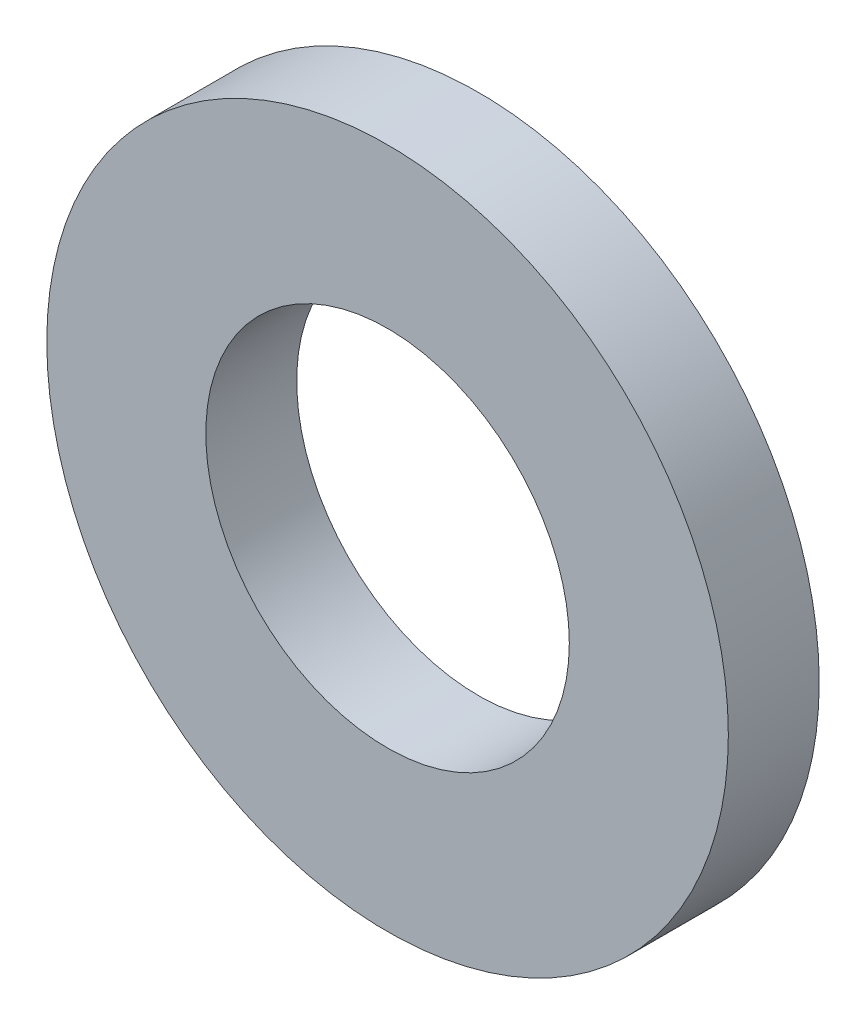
SolidWorks part; units mm, degrees
ref_plane "Ebene vorne" through (0, 0, 0) normal (0, 0, 1) x (1, 0, 0)
ref_plane "Ebene oben" through (0, 0, 0) normal (0, 1, 0) x (1, 0, 0)
ref_plane "Ebene rechts" through (0, 0, 0) normal (1, 0, 0) x (0, 0, -1)
sketch "Skizze1" plane through (0, 0, 0) normal (0, 0, 1) x (1, 0, 0)
  circle A0 centre (0, 0) radius 3.2
  circle A1 centre (0, 0) radius 6
  dimension "D1" = 6.4
  dimension "D2" = 12
extrude "Aufsatz-Linear austragen1" add sketch "Skizze1" along normal blind 1.6
